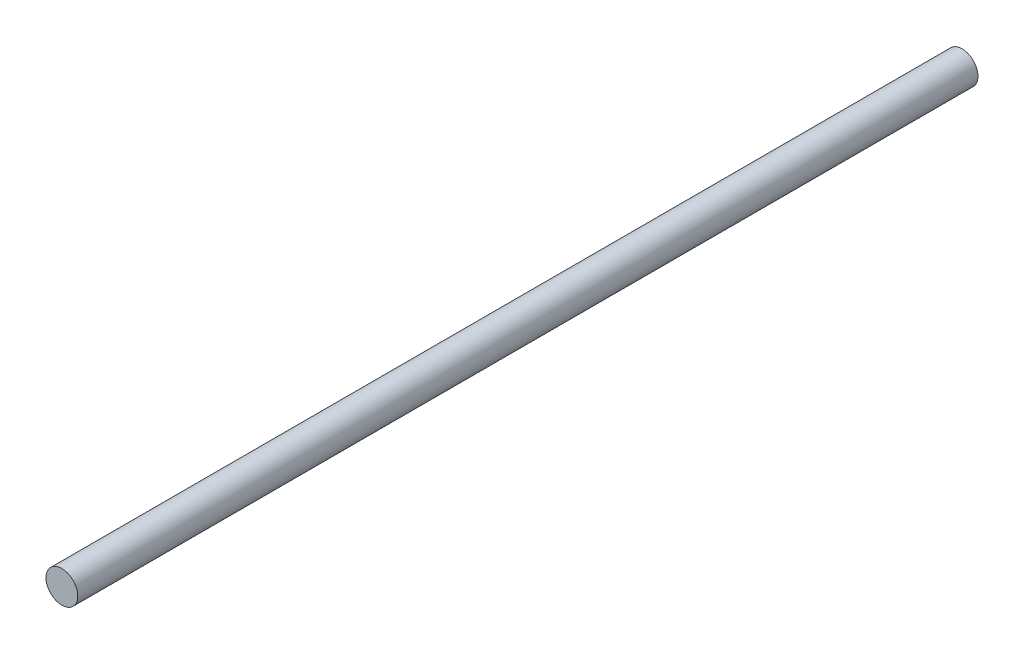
SolidWorks part; units mm, degrees
ref_plane "Front Plane" through (0, 0, 0) normal (0, 0, 1) x (1, 0, 0)
ref_plane "Top Plane" through (0, 0, 0) normal (0, 1, 0) x (1, 0, 0)
ref_plane "Right Plane" through (0, 0, 0) normal (1, 0, 0) x (0, 0, -1)
sketch "Sketch1" plane through (0, 0, 0) normal (0, 0, 1) x (1, 0, 0)
  circle A0 centre (0, 0) radius 30
  dimension "D1" = 60
extrude "Boss-Extrude1" add sketch "Sketch1" against normal blind 1700
